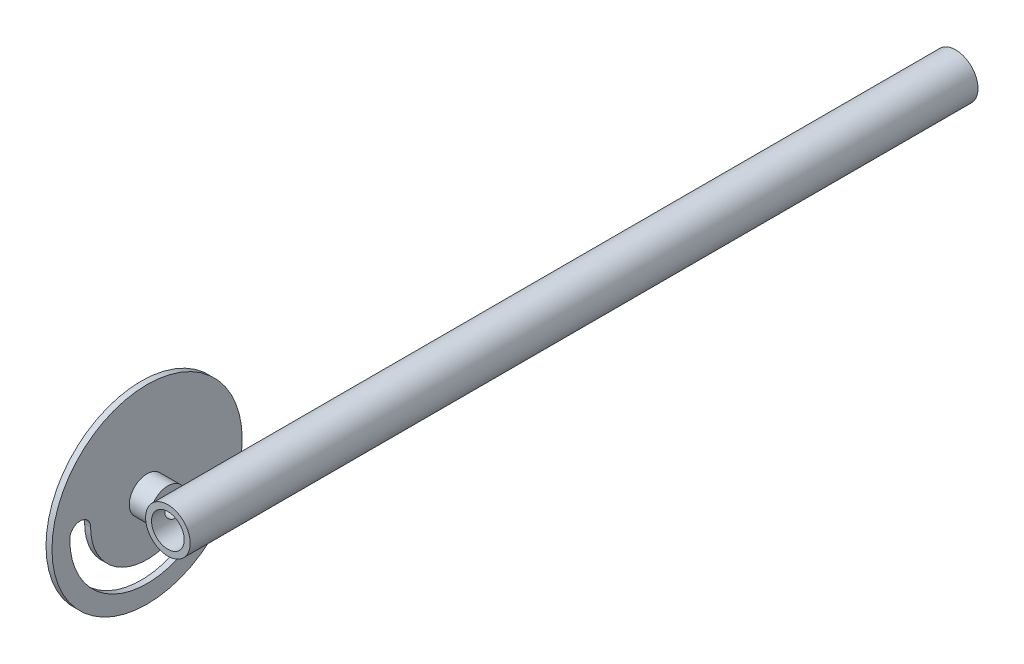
SolidWorks part; units mm, degrees
ref_plane "Plan de face" through (0, 0, 0) normal (0, 0, 1) x (1, 0, 0)
ref_plane "Plan de dessus" through (0, 0, 0) normal (0, 1, 0) x (1, 0, 0)
ref_plane "Plan de droite" through (0, 0, 0) normal (1, 0, 0) x (0, 0, -1)
ref_plane "Plan1" through (0, 0, -7) normal (0, 0, 1) x (1, 0, 0)
sketch "Esquisse1" plane through (0, 0, -7) normal (0, 0, 1) x (1, 0, 0)
  line L0 (-16, 32) -> (-16, 0)
  line L1 (-16, 0) -> (-14, 0)
  line L2 (-14, 0) -> (-14, 32)
  line L3 (-14, 32) -> (-16, 32)
  line L4 (-16, 0) -> (-14, 0) construction
revolve "Révolution1" add sketch "Esquisse1" angle 360 about L4
sketch "Esquisse2" plane through (-14, 0, 0) normal (1, 0, 0) x (0, 0, -1)
  arc A0 (-19, 0) -> (25.3848, -18.3848) centre (7, 0) ccw
  arc A1 (25.3848, -18.3848) -> (20.435, -13.435) centre (22.9099, -15.9099) ccw
  arc A2 (20.435, -13.435) -> (-12, 0) centre (7, 0) cw
  arc A3 (-12, 0) -> (-19, 0) centre (-15.5, 0) ccw
extrude "Enlèv. mat.-Extru.1" cut sketch "Esquisse2" against normal through all
sketch "Esquisse3" plane through (-14, 0, 0) normal (1, 0, 0) x (0, 0, -1)
  circle A0 centre (7, 0) radius 6
extrude "Boss.-Extru.1" add sketch "Esquisse3" along normal blind 7
sketch "Esquisse4" plane through (0, 0, 0) normal (0, 1, 0) x (1, 0, 0)
  line L0 (0, 0) -> (7.5, 0)
  line L1 (7.5, 0) -> (7.5, 265)
  line L2 (7.5, 265) -> (0, 265)
  line L3 (0, 265) -> (0, 0)
  line L4 (0, 265) -> (0, 0) construction
revolve "Révolution2" add sketch "Esquisse4" angle 360 about L4
hole_wizard "Diamètre du perçage Ø11.0 (11)1" positions "Esquisse6" profile "Esquisse5" hole size "Ø11.0" standard "Ansi Metric"
sketch "Esquisse6" plane through (0, 0, -265) normal (0, 0, -1) x (-1, 0, 0)
  point P0 (0, 0)
sketch "Esquisse5" plane through (0, 0, -265) normal (1, 0, 0) x (0, 1, 0)
  line L0 (0, 0) -> (0, 290)
  line L1 (0, 290) -> (5.5, 290)
  line L2 (5.5, 290) -> (5.5, 0)
  line L5 (5.5, 0) -> (0, 0)
  line L11 (0, -6.35) -> (0, 107.95) construction
  dimension "Diamètre du perçage jusqu'au prochain" = 11
  dimension "Profondeur du perçage jusqu'au prochain" = 290
hole_wizard "Diamètre du perçage Ø5.0 (5)1" positions "Esquisse8" profile "Esquisse7" hole size "Ø5.0" standard "Ansi Metric"
sketch "Esquisse8" plane through (-16, 0, 0) normal (-1, 0, 0) x (0, 0, 1)
  point P0 (-7, 0)
sketch "Esquisse7" plane through (-16, 0, -7) normal (0, 1, 0) x (0, 0, 1)
  line L0 (0, 0) -> (0, 10.5)
  line L1 (0, 10.5) -> (2.5, 10.5)
  line L2 (2.5, 10.5) -> (2.5, 0)
  line L5 (2.5, 0) -> (0, 0)
  line L11 (0, -6.35) -> (0, 107.95) construction
  dimension "Diamètre du perçage jusqu'au prochain" = 5
  dimension "Profondeur du perçage jusqu'au prochain" = 10.5
sketch "Esquisse9" plane through (-16, 0, 0) normal (-1, 0, 0) x (0, 0, 1)
  line L0 (15.5, 0) -> (-7, 0) construction
  line L1 (-7, 0) -> (-22.9099, -15.9099) construction
